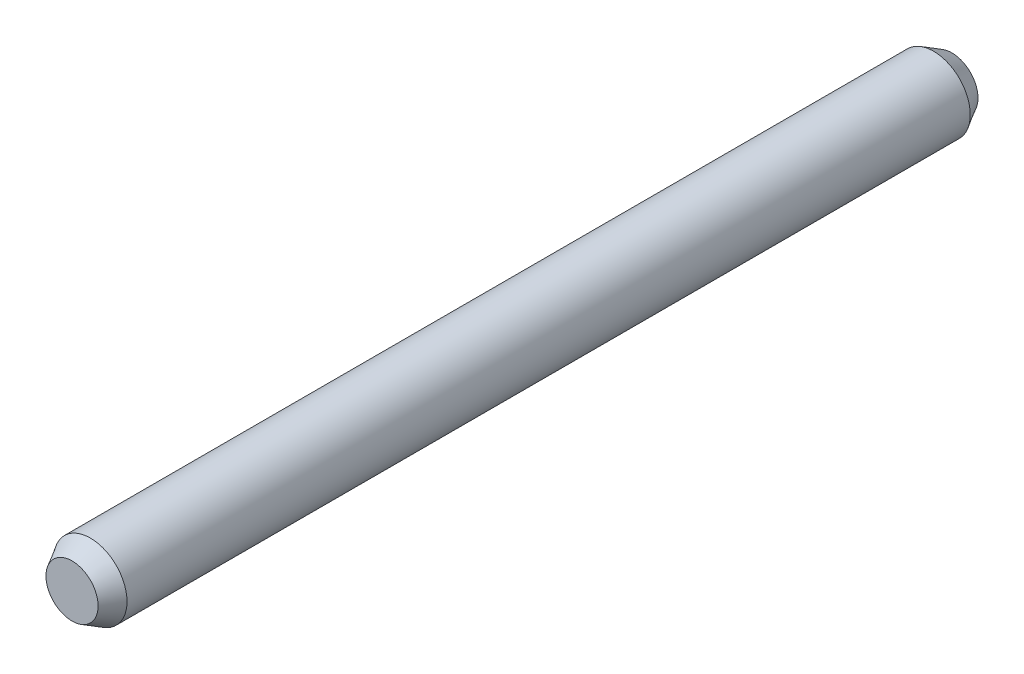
SolidWorks part; units mm, degrees
ref_plane "Plan1" through (0, 0, 0) normal (0, 0, 1) x (1, 0, 0)
ref_plane "Plan2" through (0, 0, 0) normal (0, 1, 0) x (1, 0, 0)
ref_plane "Plan3" through (0, 0, 0) normal (1, 0, 0) x (0, 0, -1)
sketch "Esquisse1" plane through (0, 0, 0) normal (0, 0, 1) x (1, 0, 0)
  circle A0 centre (0, 0) radius 1
  dimension "D1" = 2
extrude "cylindre" add sketch "Esquisse1" along normal mid plane 24
chamfer "Chanfrein1" distance 0.5 angle 30
chamfer "Chanfrein2" distance 0.5 angle 30
